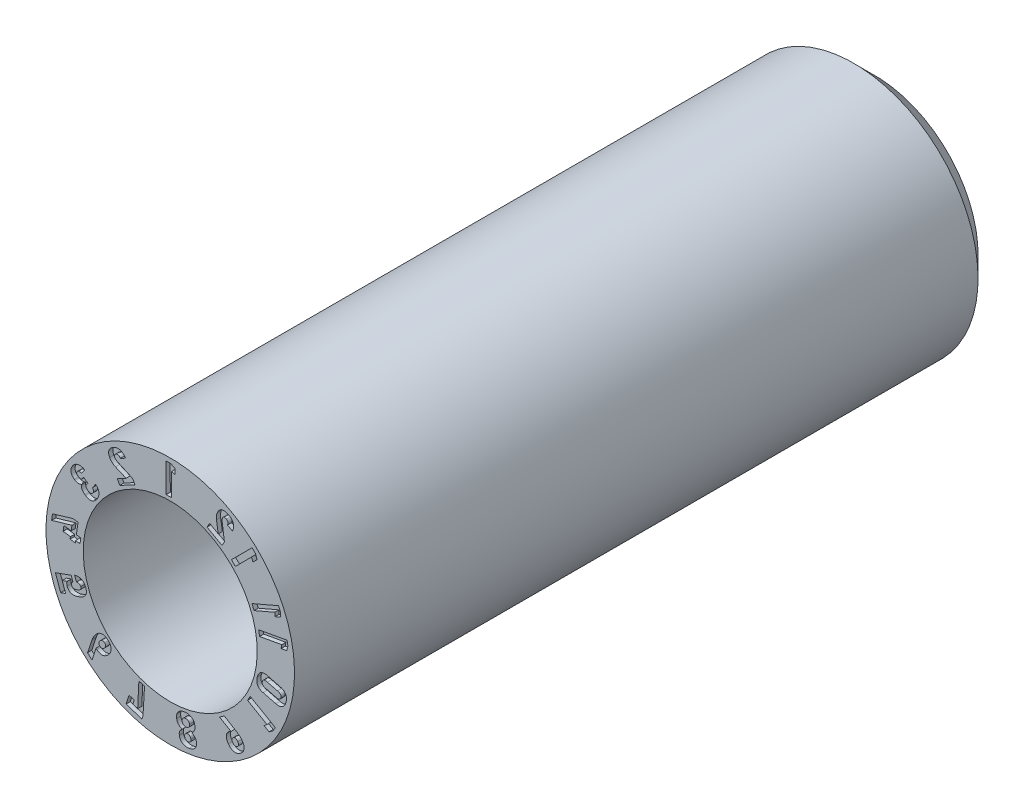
SolidWorks part; units mm, degrees
ref_plane "Front Plane" through (0, 0, 0) normal (0, 0, 1) x (1, 0, 0)
ref_plane "Top Plane" through (0, 0, 0) normal (0, 1, 0) x (1, 0, 0)
ref_plane "Right Plane" through (0, 0, 0) normal (1, 0, 0) x (0, 0, -1)
sketch "Sketch1" plane through (0, 0, 0) normal (1, 0, 0) x (0, 0, -1)
  line L0 (0, 0) -> (25.4137, 0) construction
  line L2 (17, 1.5) -> (17, 2.5)
  line L4 (16.5, 3) -> (0, 3)
  line L5 (0, 3) -> (0, 2.1)
  line L7 (0, 2.1) -> (3, 2.1)
  line L8 (3, 2.1) -> (3, 0.8)
  line L9 (3, 0.8) -> (12, 0.8)
  line L10 (17, 1.5) -> (12, 1.5)
  line L11 (12, 0.8) -> (12, 1.5)
  line L12 (17, 2.5) -> (16.5, 3)
  point P6 (17, 3)
  dimension "D1" = 17
  dimension "D2" = 6
  dimension "D3" = 4.2
  dimension "D4" = 3
  dimension "D5" = 1.6
  dimension "D6" = 3
  dimension "D7" = 5
revolve "Revolve1" add sketch "Sketch1" angle 360 about L0
sketch "Sketch2" plane through (0, 0, 0) normal (0, 0, 1) x (1, 0, 0)
  line L0 (-0.0987, 2.1834) -> (0.0335, 2.1841)
  line L1 (0.0335, 2.1841) -> (0.0306, 2.7307)
  line L2 (0.0306, 2.7307) -> (0.1164, 2.6987)
  line L3 (0.1164, 2.6987) -> (0.1157, 2.8393)
  line L4 (0.1157, 2.8393) -> (0.0106, 2.8859)
  line L5 (0.0106, 2.8859) -> (-0.1023, 2.8853)
  line L6 (-0.1023, 2.8853) -> (-0.0987, 2.1834)
  line L7 (-0.9091, 2.1158) -> (-1.27, 2.2798)
  line L8 (-1.3405, 2.3386) -> (-1.3409, 2.3394)
  line L9 (-1.1999, 2.3893) -> (-1.1997, 2.3888)
  line L10 (-1.1997, 2.3888) -> (-1.0807, 2.4529)
  line L11 (-1.0807, 2.4529) -> (-1.0809, 2.4533)
  line L12 (-1.4621, 2.2785) -> (-1.4619, 2.278)
  line L13 (-1.3214, 2.15) -> (-1.0667, 2.0403)
  line L14 (-1.0667, 2.0403) -> (-1.2772, 1.9269)
  line L15 (-1.2772, 1.9269) -> (-1.2169, 1.8151)
  line L16 (-1.2169, 1.8151) -> (-0.8528, 2.0112)
  line L17 (-0.8528, 2.0112) -> (-0.9091, 2.1158)
  line L18 (-1.8019, 1.545) -> (-1.88, 1.4339)
  line L19 (-1.977, 1.3167) -> (-1.9904, 1.3261)
  line L20 (-2.0216, 1.4261) -> (-1.9876, 1.4743)
  line L21 (-1.9876, 1.4743) -> (-2.0913, 1.5472)
  line L22 (-2.0913, 1.5472) -> (-2.1253, 1.499)
  line L23 (-2.2144, 1.4976) -> (-2.2242, 1.5044)
  line L24 (-2.1416, 1.6044) -> (-2.0638, 1.7151)
  line L25 (-2.3162, 1.3967) -> (-2.299, 1.3846)
  line L26 (-2.0634, 1.2048) -> (-2.046, 1.1927)
  line L27 (-2.3464, 0.5569) -> (-2.843, 0.4089)
  line L28 (-2.843, 0.4089) -> (-2.8638, 0.2611)
  line L29 (-2.8638, 0.2611) -> (-2.3738, 0.404)
  line L30 (-2.3738, 0.404) -> (-2.3916, 0.2776)
  line L31 (-2.4176, 0.0926) -> (-2.2918, 0.0749)
  line L32 (-2.2918, 0.0749) -> (-2.2842, 0.1292)
  line L33 (-2.2263, 0.5399) -> (-2.3464, 0.5569)
  line L34 (-2.5671, 0.3024) -> (-2.5856, 0.1718)
  line L35 (-2.5856, 0.1718) -> (-2.41, 0.147)
  line L36 (-2.1774, 0.1142) -> (-2.1589, 0.2448)
  line L37 (-2.1589, 0.2448) -> (-2.2657, 0.2599)
  line L38 (-2.3072, -0.6044) -> (-2.3077, -0.6045)
  line L39 (-2.3077, -0.6045) -> (-2.2632, -0.7292)
  line L40 (-2.2632, -0.7292) -> (-2.2627, -0.729)
  line L41 (-2.218, -0.8704) -> (-2.2735, -0.8901)
  line L42 (-2.3505, -0.7675) -> (-2.392, -0.6512)
  line L43 (-2.392, -0.6512) -> (-2.7721, -0.7868)
  line L44 (-2.7721, -0.7868) -> (-2.6453, -1.1419)
  line L45 (-2.6453, -1.1419) -> (-2.5252, -1.099)
  line L46 (-2.5252, -1.099) -> (-2.6075, -0.8686)
  line L47 (-2.6075, -0.8686) -> (-2.4908, -0.8269)
  line L48 (-2.229, -1.0148) -> (-2.1735, -0.995)
  line L49 (-1.7904, -1.5806) -> (-1.7907, -1.5809)
  line L50 (-1.8896, -1.7544) -> (-1.9951, -2.07)
  line L51 (-1.9951, -2.07) -> (-1.8872, -2.1731)
  line L52 (-1.8872, -2.1731) -> (-1.7893, -1.871)
  line L54 (-1.4966, -1.8653) -> (-1.4963, -1.8652)
  line L55 (-1.5858, -1.768) -> (-1.5862, -1.7684)
  line L56 (-1.6911, -1.6673) -> (-1.6909, -1.667)
  line L57 (-0.6569, -2.7176) -> (-0.6211, -2.0858)
  line L58 (-0.6211, -2.0858) -> (-0.7576, -2.0425)
  line L59 (-0.7576, -2.0425) -> (-0.7859, -2.6352)
  line L60 (-0.7859, -2.6352) -> (-0.9006, -2.5987)
  line L61 (-0.9006, -2.5987) -> (-0.8687, -2.4981)
  line L62 (-0.8687, -2.4981) -> (-0.9946, -2.4582)
  line L63 (-0.9946, -2.4582) -> (-1.0651, -2.6802)
  line L64 (-1.0651, -2.6802) -> (-0.6834, -2.8013)
  line L65 (-0.6834, -2.8013) -> (-0.6569, -2.7176)
  line L66 (0.154, -2.3657) -> (0.1558, -2.3772)
  line L67 (0.2187, -2.6783) -> (0.2215, -2.6964)
  line L68 (0.6326, -2.6306) -> (0.6298, -2.6125)
  line L69 (0.5955, -2.3068) -> (0.5937, -2.2954)
  line L70 (0.4661, -2.3352) -> (0.4671, -2.3419)
  line L71 (0.2886, -2.37) -> (0.2875, -2.3629)
  line L72 (0.4983, -2.628) -> (0.4993, -2.6348)
  line L73 (0.3495, -2.6582) -> (0.3483, -2.651)
  line L75 (1.402, -2.2767) -> (1.4023, -2.2771)
  line L76 (1.7311, -2.0356) -> (1.7309, -2.0352)
  line L77 (1.58, -1.9107) -> (1.3037, -1.7421)
  line L78 (1.3037, -1.7421) -> (1.1913, -1.8237)
  line L79 (1.1913, -1.8237) -> (1.4667, -1.9853)
  line L80 (1.6282, -2.1174) -> (1.6285, -2.1178)
  line L81 (1.5106, -2.2027) -> (1.5102, -2.2023)
  line L82 (1.9319, -1.0216) -> (1.8661, -1.1352)
  line L83 (1.8661, -1.1352) -> (2.3356, -1.4072)
  line L84 (2.3356, -1.4072) -> (2.265, -1.4646)
  line L85 (2.265, -1.4646) -> (2.3858, -1.5345)
  line L86 (2.3858, -1.5345) -> (2.4786, -1.4681)
  line L87 (2.4786, -1.4681) -> (2.5348, -1.3711)
  line L88 (2.5348, -1.3711) -> (1.9319, -1.0216)
  line L89 (2.2403, -0.7867) -> (2.5498, -0.8652)
  line L90 (2.653, -0.4579) -> (2.3435, -0.3794)
  line L91 (2.3439, -0.516) -> (2.5878, -0.578)
  line L92 (2.5495, -0.7286) -> (2.3057, -0.6667)
  line L93 (2.1337, 0.4734) -> (2.1571, 0.3438)
  line L94 (2.1571, 0.3438) -> (2.6922, 0.4405)
  line L95 (2.6922, 0.4405) -> (2.6755, 0.3512)
  line L96 (2.6755, 0.3512) -> (2.8131, 0.376)
  line L97 (2.8131, 0.376) -> (2.8409, 0.4869)
  line L98 (2.8409, 0.4869) -> (2.8209, 0.5975)
  line L99 (2.8209, 0.5975) -> (2.1337, 0.4734)
  line L100 (1.9726, 0.9402) -> (2.0246, 0.8192)
  line L101 (2.0246, 0.8192) -> (2.5239, 1.0342)
  line L102 (2.5239, 1.0342) -> (2.5279, 0.9436)
  line L103 (2.5279, 0.9436) -> (2.6563, 0.9988)
  line L104 (2.6563, 0.9988) -> (2.6583, 1.1131)
  line L105 (2.6583, 1.1131) -> (2.6139, 1.2162)
  line L106 (2.6139, 1.2162) -> (1.9726, 0.9402)
  line L107 (1.4782, 1.61) -> (1.5723, 1.5162)
  line L108 (1.5723, 1.5162) -> (1.9593, 1.905)
  line L109 (1.9593, 1.905) -> (1.9973, 1.8216)
  line L110 (1.9973, 1.8216) -> (2.0967, 1.9214)
  line L111 (2.0967, 1.9214) -> (2.0556, 2.0294)
  line L112 (2.0556, 2.0294) -> (1.9752, 2.1093)
  line L113 (1.9752, 2.1093) -> (1.4782, 1.61)
  line L114 (1.3071, 1.8963) -> (1.2536, 2.2895)
  line L115 (1.2658, 2.3805) -> (1.2662, 2.3812)
  line L116 (1.3834, 2.2882) -> (1.3832, 2.2878)
  line L117 (1.3832, 2.2878) -> (1.5011, 2.2211)
  line L118 (1.5011, 2.2211) -> (1.5013, 2.2216)
  line L119 (1.1502, 2.4515) -> (1.1499, 2.4512)
  line L120 (1.1163, 2.2638) -> (1.1589, 1.9896)
  line L121 (1.1589, 1.9896) -> (0.9507, 2.1075)
  line L122 (0.9507, 2.1075) -> (0.888, 1.9968)
  line L123 (0.888, 1.9968) -> (1.2485, 1.7927)
  line L124 (1.2485, 1.7927) -> (1.3071, 1.8963)
  line L125 (-2.41, 0.147) -> (-2.4176, 0.0926)
  line L126 (-2.3916, 0.2776) -> (-2.5671, 0.3024)
  line L127 (-2.2657, 0.2599) -> (-2.2263, 0.5399)
  line L128 (-2.2842, 0.1292) -> (-2.1774, 0.1142)
  circle A0 centre (0, 0) radius 2.19 construction
  spline S0 degree 3 poles (-1.27, 2.2798) (-1.2852, 2.2868) (-1.3035, 2.2972) (-1.3214, 2.3137) (-1.3313, 2.3241) (-1.3372, 2.3327) (-1.3405, 2.3386) knots 0 0 0 0 0.540031 0.665532 0.783527 1 1 1 1
  spline S1 degree 3 poles (-1.3409, 2.3394) (-1.3452, 2.3469) (-1.3493, 2.3589) (-1.3491, 2.3754) (-1.3459, 2.3869) (-1.3401, 2.3978) (-1.3281, 2.412) (-1.3159, 2.4199) (-1.3071, 2.4247) knots 0 0 0 0 0.246786 0.35691 0.469448 0.586307 0.710254 1 1 1 1
  spline S2 degree 3 poles (-1.3071, 2.4247) (-1.2983, 2.4294) (-1.284, 2.4345) (-1.2643, 2.4345) (-1.25, 2.4313) (-1.2363, 2.4251) (-1.218, 2.4124) (-1.2067, 2.3991) (-1.1999, 2.3893) knots 0 0 0 0 0.240301 0.353786 0.468513 0.587497 0.712892 1 1 1 1
  spline S3 degree 3 poles (-1.0809, 2.4533) (-1.0919, 2.4707) (-1.1101, 2.4948) (-1.1389, 2.5215) (-1.1614, 2.5375) (-1.185, 2.5502) (-1.2095, 2.5594) (-1.2349, 2.5646) (-1.2608, 2.5665) (-1.2872, 2.5647) (-1.3234, 2.5569) (-1.3497, 2.5462) (-1.3665, 2.537) knots 0 0 0 0 0.185247 0.270908 0.353799 0.433963 0.511943 0.589015 0.666847 0.746166 0.827199 1 1 1 1
  spline S4 degree 3 poles (-1.3665, 2.537) (-1.3843, 2.5274) (-1.4093, 2.5113) (-1.4378, 2.4857) (-1.4549, 2.4657) (-1.4687, 2.4448) (-1.4788, 2.423) (-1.4855, 2.4002) (-1.4881, 2.3766) (-1.4874, 2.3525) (-1.4808, 2.3188) (-1.4707, 2.2943) (-1.4621, 2.2785) knots 0 0 0 0 0.194583 0.283015 0.366623 0.445927 0.521986 0.596945 0.671952 0.748458 0.827747 1 1 1 1
  spline S5 degree 3 poles (-1.4619, 2.278) (-1.4542, 2.2641) (-1.4412, 2.2439) (-1.42, 2.2196) (-1.4027, 2.2024) (-1.384, 2.1866) (-1.3574, 2.168) (-1.3362, 2.1564) (-1.3214, 2.15) knots 0 0 0 0 0.246636 0.37153 0.498651 0.625609 0.751024 1 1 1 1
  spline S6 degree 3 poles (-1.7706, 1.2497) (-1.7591, 1.2661) (-1.7441, 1.2917) (-1.7306, 1.328) (-1.724, 1.3547) (-1.7212, 1.3814) (-1.7215, 1.4078) (-1.726, 1.4335) (-1.7336, 1.4586) (-1.7452, 1.4827) (-1.7661, 1.5135) (-1.7866, 1.5333) (-1.8019, 1.545) knots 0 0 0 0 0.181473 0.266228 0.349031 0.429721 0.5081 0.58621 0.664895 0.744781 0.826358 1 1 1 1
  spline S7 degree 3 poles (-1.88, 1.4339) (-1.8749, 1.4293) (-1.8681, 1.4218) (-1.861, 1.4108) (-1.8569, 1.4026) (-1.8542, 1.3941) (-1.8525, 1.3856) (-1.8521, 1.377) (-1.8526, 1.3684) (-1.8545, 1.3598) (-1.8584, 1.3481) (-1.8634, 1.3401) (-1.8668, 1.3348) knots 0 0 0 0 0.185948 0.272003 0.355057 0.435081 0.512073 0.590042 0.667455 0.74622 0.82701 1 1 1 1
  spline S8 degree 3 poles (-1.8668, 1.3348) (-1.8732, 1.3255) (-1.8844, 1.3134) (-1.9028, 1.3029) (-1.9171, 1.299) (-1.9319, 1.2983) (-1.953, 1.3023) (-1.9677, 1.3103) (-1.977, 1.3167) knots 0 0 0 0 0.265502 0.382854 0.496664 0.611875 0.731229 1 1 1 1
  spline S9 degree 3 poles (-1.9904, 1.3261) (-1.9998, 1.3331) (-2.0135, 1.3437) (-2.0257, 1.3617) (-2.0316, 1.3745) (-2.0343, 1.3877) (-2.0329, 1.4059) (-2.0272, 1.4186) (-2.0216, 1.4261) knots 0 0 0 0 0.300615 0.42856 0.545417 0.656048 0.764757 1 1 1 1
  spline S10 degree 3 poles (-2.1253, 1.499) (-2.1295, 1.4926) (-2.1379, 1.4849) (-2.1519, 1.4791) (-2.1633, 1.4779) (-2.1754, 1.4788) (-2.1933, 1.4845) (-2.2062, 1.4915) (-2.2144, 1.4976) knots 0 0 0 0 0.226653 0.333129 0.444988 0.564971 0.694922 1 1 1 1
  spline S11 degree 3 poles (-2.2242, 1.5044) (-2.2319, 1.51) (-2.2427, 1.519) (-2.2523, 1.534) (-2.2565, 1.5451) (-2.2579, 1.5566) (-2.2565, 1.5725) (-2.2505, 1.5835) (-2.2459, 1.5902) knots 0 0 0 0 0.287811 0.411477 0.527914 0.639876 0.752931 1 1 1 1
  spline S12 degree 3 poles (-2.2459, 1.5902) (-2.2426, 1.5949) (-2.2368, 1.6014) (-2.2274, 1.6078) (-2.2198, 1.6117) (-2.2116, 1.6147) (-2.2029, 1.6164) (-2.1936, 1.6171) (-2.1839, 1.6168) (-2.1737, 1.6153) (-2.1593, 1.6119) (-2.1487, 1.6076) (-2.1416, 1.6044) knots 0 0 0 0 0.150181 0.223297 0.297156 0.371585 0.449302 0.529052 0.614285 0.702509 0.795753 1 1 1 1
  spline S13 degree 3 poles (-2.0638, 1.7151) (-2.0812, 1.7252) (-2.1084, 1.7376) (-2.146, 1.7474) (-2.1733, 1.7508) (-2.2001, 1.7509) (-2.2261, 1.7475) (-2.2509, 1.7405) (-2.2747, 1.7304) (-2.297, 1.717) (-2.3252, 1.6953) (-2.3428, 1.6746) (-2.3532, 1.6599) knots 0 0 0 0 0.185488 0.271925 0.356057 0.43765 0.517094 0.59543 0.674143 0.753752 0.833671 1 1 1 1
  spline S14 degree 3 poles (-2.3532, 1.6599) (-2.3618, 1.648) (-2.3727, 1.6296) (-2.3845, 1.6044) (-2.3911, 1.5862) (-2.3956, 1.5681) (-2.3981, 1.5503) (-2.3987, 1.5326) (-2.3971, 1.5153) (-2.3939, 1.4984) (-2.3884, 1.4821) (-2.3813, 1.4663) (-2.3722, 1.451) (-2.361, 1.4364) (-2.343, 1.4175) (-2.3276, 1.4045) (-2.3162, 1.3967) knots 0 0 0 0 0.145025 0.211773 0.27583 0.33709 0.396198 0.454481 0.511605 0.568407 0.62506 0.681891 0.740574 0.801023 0.863801 1 1 1 1
  spline S15 degree 3 poles (-2.299, 1.3846) (-2.2864, 1.376) (-2.2665, 1.3648) (-2.2374, 1.3577) (-2.2158, 1.3554) (-2.1941, 1.3568) (-2.165, 1.3635) (-2.1446, 1.3736) (-2.1317, 1.382) knots 0 0 0 0 0.256766 0.378903 0.500094 0.620744 0.742279 1 1 1 1
  spline S16 degree 3 poles (-2.1317, 1.382) (-2.135, 1.3743) (-2.1385, 1.3625) (-2.1413, 1.3464) (-2.1421, 1.3346) (-2.1416, 1.3227) (-2.1402, 1.3109) (-2.1373, 1.2993) (-2.1322, 1.2836) (-2.1227, 1.2645) (-2.101, 1.2348) (-2.0794, 1.216) (-2.0634, 1.2048) knots 0 0 0 0 0.120942 0.178738 0.235933 0.293132 0.35041 0.408041 0.467423 0.589012 0.716166 1 1 1 1
  spline S17 degree 3 poles (-2.046, 1.1927) (-2.0303, 1.182) (-2.0063, 1.1677) (-1.972, 1.1564) (-1.9472, 1.1518) (-1.9226, 1.151) (-1.8986, 1.1542) (-1.875, 1.1608) (-1.8523, 1.1716) (-1.8301, 1.1858) (-1.801, 1.2104) (-1.7823, 1.2333) (-1.7706, 1.2497) knots 0 0 0 0 0.178299 0.259715 0.338099 0.414262 0.489196 0.564778 0.643204 0.724723 0.810858 1 1 1 1
  spline S18 degree 3 poles (-2.0403, -0.7275) (-2.0462, -0.7104) (-2.0582, -0.6864) (-2.0794, -0.6581) (-2.0975, -0.6397) (-2.1178, -0.624) (-2.1403, -0.6117) (-2.1645, -0.602) (-2.1907, -0.5957) (-2.2183, -0.5926) (-2.2577, -0.5932) (-2.2875, -0.5988) (-2.3072, -0.6044) knots 0 0 0 0 0.165351 0.244288 0.323078 0.400982 0.47883 0.557644 0.639484 0.72423 0.811685 1 1 1 1
  spline S19 degree 3 poles (-2.2627, -0.729) (-2.2514, -0.7261) (-2.2343, -0.7236) (-2.2125, -0.7262) (-2.1982, -0.7305) (-2.1856, -0.7375) (-2.171, -0.7502) (-2.164, -0.7634) (-2.1606, -0.7725) knots 0 0 0 0 0.28598 0.412917 0.532389 0.648289 0.760986 1 1 1 1
  spline S20 degree 3 poles (-2.1606, -0.7725) (-2.1572, -0.7823) (-2.1538, -0.7978) (-2.1576, -0.8178) (-2.1635, -0.8313) (-2.1728, -0.8434) (-2.1899, -0.8586) (-2.2064, -0.8661) (-2.218, -0.8704) knots 0 0 0 0 0.245538 0.357255 0.469313 0.585745 0.711147 1 1 1 1
  spline S21 degree 3 poles (-2.2735, -0.8901) (-2.2851, -0.8943) (-2.3023, -0.8988) (-2.3248, -0.899) (-2.3392, -0.896) (-2.3519, -0.8905) (-2.3664, -0.879) (-2.3736, -0.8668) (-2.3766, -0.8579) knots 0 0 0 0 0.302844 0.431574 0.550434 0.661796 0.769579 1 1 1 1
  spline S22 degree 3 poles (-2.3766, -0.8579) (-2.3796, -0.8496) (-2.3825, -0.8366) (-2.3821, -0.8194) (-2.3797, -0.8073) (-2.3752, -0.7958) (-2.3666, -0.7814) (-2.3573, -0.7726) (-2.3505, -0.7675) knots 0 0 0 0 0.263342 0.385863 0.507648 0.627192 0.748066 1 1 1 1
  spline S23 degree 3 poles (-2.4908, -0.8269) (-2.4939, -0.8335) (-2.4967, -0.8446) (-2.4986, -0.8603) (-2.4989, -0.8861) (-2.4949, -0.9078) (-2.4893, -0.9243) knots 0 0 0 0 0.221259 0.342937 0.474198 1 1 1 1
  spline S24 degree 3 poles (-2.4893, -0.9243) (-2.4835, -0.9404) (-2.4724, -0.963) (-2.452, -0.9886) (-2.4346, -1.0041) (-2.4152, -1.0169) (-2.3936, -1.0263) (-2.3701, -1.0323) (-2.3448, -1.0354) (-2.3178, -1.0349) (-2.2784, -1.0306) (-2.2489, -1.0217) (-2.229, -1.0148) knots 0 0 0 0 0.163657 0.239511 0.313509 0.387354 0.461741 0.538607 0.619723 0.705858 0.797119 1 1 1 1
  spline S25 degree 3 poles (-2.1735, -0.995) (-2.1536, -0.9879) (-2.1253, -0.9751) (-2.0924, -0.9523) (-2.0719, -0.9336) (-2.0549, -0.9131) (-2.0415, -0.8908) (-2.0318, -0.8668) (-2.0258, -0.8413) (-2.0237, -0.8144) (-2.0259, -0.7758) (-2.0336, -0.7468) (-2.0403, -0.7275) knots 0 0 0 0 0.18694 0.272046 0.353269 0.43122 0.506711 0.581925 0.65865 0.737396 0.819504 1 1 1 1
  spline S26 degree 3 poles (-1.4966, -1.5692) (-1.5111, -1.5553) (-1.5342, -1.5369) (-1.5681, -1.5192) (-1.5932, -1.5101) (-1.6186, -1.5053) (-1.644, -1.5042) (-1.6694, -1.5071) (-1.6947, -1.514) (-1.7196, -1.5251) (-1.7534, -1.5452) (-1.7759, -1.5658) (-1.7904, -1.5806) knots 0 0 0 0 0.180177 0.262991 0.342265 0.419093 0.494073 0.569807 0.647689 0.728634 0.813436 1 1 1 1
  spline S27 degree 3 poles (-1.7907, -1.5809) (-1.7998, -1.5903) (-1.8126, -1.6056) (-1.8283, -1.6275) (-1.8518, -1.6644) (-1.8679, -1.6977) (-1.8789, -1.7254) knots 0 0 0 0 0.230123 0.350639 0.475699 1 1 1 1
  spline S28 degree 3 poles (-1.8789, -1.7254) (-1.8808, -1.7302) (-1.8849, -1.7397) (-1.8879, -1.7496) (-1.8896, -1.7544) knots 0 0 0 0 0.50536 1 1 1 1
  spline S29 degree 3 poles (-1.7893, -1.871) (-1.7844, -1.878) (-1.7787, -1.8843) (-1.7726, -1.8902) knots 0.759919 0.759919 0.759919 0.759919 1 1 1 1
  spline S30 degree 3 poles (-1.7726, -1.8902) (-1.7596, -1.9026) (-1.7387, -1.9191) (-1.7077, -1.934) (-1.6846, -1.9413) (-1.661, -1.9446) (-1.6372, -1.9445) (-1.6133, -1.9402) (-1.5893, -1.9325) (-1.5655, -1.9209) (-1.5328, -1.9004) (-1.5108, -1.8801) (-1.4966, -1.8653) knots 0 0 0 0 0.171911 0.25061 0.326761 0.401984 0.476839 0.553147 0.632554 0.716253 0.804371 1 1 1 1
  spline S31 degree 3 poles (-1.4963, -1.8652) (-1.4816, -1.8501) (-1.4625, -1.826) (-1.4433, -1.7912) (-1.4334, -1.7655) (-1.4272, -1.7398) (-1.4254, -1.714) (-1.4273, -1.6885) (-1.4335, -1.6633) (-1.4434, -1.6386) (-1.4627, -1.6055) (-1.4821, -1.5831) (-1.4966, -1.5692) knots 0 0 0 0 0.187278 0.272507 0.353965 0.431955 0.507955 0.583051 0.659476 0.73806 0.820178 1 1 1 1
  spline S32 degree 3 poles (-1.5845, -1.661) (-1.5769, -1.6682) (-1.567, -1.6803) (-1.5604, -1.6992) (-1.559, -1.7132) (-1.5609, -1.7274) (-1.5681, -1.747) (-1.578, -1.76) (-1.5858, -1.768) knots 0 0 0 0 0.25988 0.375973 0.488654 0.604089 0.724464 1 1 1 1
  spline S33 degree 3 poles (-1.5862, -1.7684) (-1.5951, -1.7776) (-1.6091, -1.7902) (-1.6305, -1.8002) (-1.6456, -1.8041) (-1.6606, -1.8042) (-1.6806, -1.7995) (-1.6936, -1.7903) (-1.7012, -1.783) knots 0 0 0 0 0.294468 0.419976 0.537202 0.647939 0.758507 1 1 1 1
  spline S34 degree 3 poles (-1.7012, -1.783) (-1.7088, -1.7759) (-1.7184, -1.7632) (-1.7237, -1.7434) (-1.724, -1.7284) (-1.7209, -1.713) (-1.7114, -1.6913) (-1.7001, -1.6765) (-1.6911, -1.6673) knots 0 0 0 0 0.24016 0.350245 0.463156 0.580574 0.706813 1 1 1 1
  spline S35 degree 3 poles (-1.6909, -1.667) (-1.6832, -1.659) (-1.6706, -1.6486) (-1.6514, -1.6403) (-1.6374, -1.638) (-1.6234, -1.6387) (-1.6045, -1.6448) (-1.5919, -1.6537) (-1.5845, -1.661) knots 0 0 0 0 0.277062 0.397428 0.512563 0.62626 0.741394 1 1 1 1
  spline S36 degree 3 poles (0.343, -2.1378) (0.3223, -2.1413) (0.2921, -2.1483) (0.2555, -2.165) (0.2311, -2.1795) (0.2097, -2.1965) (0.1912, -2.2154) (0.1762, -2.2367) (0.1644, -2.2598) (0.156, -2.2845) (0.15, -2.32) (0.1509, -2.3475) (0.154, -2.3657) knots 0 0 0 0 0.188977 0.27682 0.361569 0.443246 0.522148 0.599298 0.677101 0.755105 0.83325 1 1 1 1
  spline S37 degree 3 poles (0.1558, -2.3772) (0.1585, -2.3942) (0.1664, -2.4191) (0.1834, -2.4496) (0.1997, -2.4706) (0.2183, -2.4897) (0.2466, -2.5109) (0.2706, -2.5222) (0.2874, -2.5272) knots 0 0 0 0 0.24595 0.369875 0.497302 0.624923 0.749887 1 1 1 1
  spline S38 degree 3 poles (0.2874, -2.5272) (0.2752, -2.5358) (0.2584, -2.5509) (0.2409, -2.5752) (0.2303, -2.5948) (0.2225, -2.6153) (0.2162, -2.6431) (0.2164, -2.6645) (0.2187, -2.6783) knots 0 0 0 0 0.256726 0.383635 0.511859 0.637851 0.759402 1 1 1 1
  spline S39 degree 3 poles (0.2215, -2.6964) (0.2243, -2.7136) (0.2313, -2.7386) (0.2472, -2.7685) (0.2619, -2.7883) (0.2791, -2.8056) (0.2989, -2.82) (0.3206, -2.832) (0.3447, -2.8408) (0.3706, -2.847) (0.4081, -2.8505) (0.4369, -2.849) (0.4562, -2.8456) knots 0 0 0 0 0.166884 0.246053 0.324356 0.402056 0.479239 0.557959 0.639716 0.724649 0.812019 1 1 1 1
  spline S40 degree 3 poles (0.4562, -2.8456) (0.4755, -2.8423) (0.5037, -2.8356) (0.5379, -2.82) (0.5606, -2.8063) (0.5806, -2.7903) (0.5979, -2.7722) (0.6119, -2.7522) (0.623, -2.7304) (0.6306, -2.7071) (0.6367, -2.6737) (0.6353, -2.6478) (0.6326, -2.6306) knots 0 0 0 0 0.188035 0.275676 0.359981 0.441818 0.520591 0.598495 0.675899 0.754169 0.832942 1 1 1 1
  spline S41 degree 3 poles (0.6298, -2.6125) (0.6278, -2.5984) (0.6209, -2.5779) (0.6062, -2.5531) (0.592, -2.5362) (0.5756, -2.5211) (0.5513, -2.5036) (0.5303, -2.495) (0.5159, -2.4907) knots 0 0 0 0 0.242626 0.3641 0.490539 0.617681 0.743637 1 1 1 1
  spline S42 degree 3 poles (0.5159, -2.4907) (0.5306, -2.4807) (0.5498, -2.4621) (0.5705, -2.4331) (0.5825, -2.4092) (0.5916, -2.3842) (0.5988, -2.35) (0.5983, -2.3238) (0.5955, -2.3068) knots 0 0 0 0 0.252226 0.376998 0.504745 0.631563 0.754935 1 1 1 1
  spline S43 degree 3 poles (0.5937, -2.2954) (0.591, -2.277) (0.5833, -2.2506) (0.5664, -2.2188) (0.5508, -2.198) (0.5323, -2.1798) (0.5116, -2.164) (0.4879, -2.1519) (0.4623, -2.1424) (0.4346, -2.1363) (0.3946, -2.1321) (0.3637, -2.1345) (0.343, -2.1378) knots 0 0 0 0 0.166554 0.245226 0.322916 0.400249 0.47767 0.556369 0.63832 0.723174 0.810916 1 1 1 1
  spline S44 degree 3 poles (0.3632, -2.2637) (0.3715, -2.2623) (0.384, -2.2617) (0.4002, -2.2637) (0.4114, -2.2668) (0.4219, -2.2713) (0.4317, -2.2767) (0.4402, -2.2839) (0.4478, -2.2921) (0.4544, -2.3015) (0.4617, -2.3155) (0.4648, -2.3272) (0.4661, -2.3352) knots 0 0 0 0 0.180053 0.264369 0.347011 0.427481 0.50643 0.584318 0.66459 0.745066 0.82721 1 1 1 1
  spline S45 degree 3 poles (0.4671, -2.3419) (0.4681, -2.3493) (0.4688, -2.3605) (0.4662, -2.3749) (0.4627, -2.3849) (0.4578, -2.3942) (0.4518, -2.4029) (0.4443, -2.4106) (0.4356, -2.4175) (0.4257, -2.4234) (0.411, -2.4302) (0.3988, -2.4331) (0.3904, -2.4345) knots 0 0 0 0 0.166389 0.245774 0.324127 0.401036 0.478754 0.557638 0.639825 0.724353 0.811459 1 1 1 1
  spline S46 degree 3 poles (0.3904, -2.4345) (0.382, -2.4357) (0.3695, -2.4368) (0.3533, -2.4351) (0.3422, -2.4325) (0.3318, -2.4287) (0.3224, -2.4234) (0.3138, -2.4172) (0.3062, -2.4097) (0.2997, -2.4011) (0.2929, -2.3882) (0.2897, -2.3775) (0.2886, -2.37) knots 0 0 0 0 0.188474 0.275198 0.360269 0.441191 0.520185 0.597926 0.676115 0.755046 0.834173 1 1 1 1
  spline S47 degree 3 poles (0.2875, -2.3629) (0.2862, -2.3549) (0.2857, -2.3429) (0.288, -2.3273) (0.2914, -2.3165) (0.296, -2.3063) (0.3021, -2.2971) (0.3096, -2.2888) (0.3183, -2.2815) (0.328, -2.2751) (0.3429, -2.2683) (0.3548, -2.2649) (0.3632, -2.2637) knots 0 0 0 0 0.173778 0.254718 0.335683 0.414821 0.493743 0.571177 0.652365 0.735479 0.820481 1 1 1 1
  spline S48 degree 3 poles (0.4108, -2.5613) (0.4178, -2.56) (0.4285, -2.5596) (0.4422, -2.5617) (0.4517, -2.5646) (0.4606, -2.5687) (0.4688, -2.574) (0.4762, -2.5804) (0.4826, -2.5882) (0.4882, -2.5969) (0.4942, -2.61) (0.4973, -2.6206) (0.4983, -2.628) knots 0 0 0 0 0.173838 0.255177 0.335334 0.414326 0.491269 0.570236 0.650821 0.73402 0.818688 1 1 1 1
  spline S49 degree 3 poles (0.4993, -2.6348) (0.5003, -2.6416) (0.5011, -2.652) (0.499, -2.6653) (0.4964, -2.6745) (0.4926, -2.6833) (0.4874, -2.6911) (0.4813, -2.6983) (0.474, -2.7045) (0.4658, -2.71) (0.4534, -2.7159) (0.4431, -2.7184) (0.436, -2.7197) knots 0 0 0 0 0.175248 0.257091 0.338037 0.416807 0.495075 0.573435 0.65385 0.735675 0.820091 1 1 1 1
  spline S50 degree 3 poles (0.436, -2.7197) (0.429, -2.7207) (0.4184, -2.7217) (0.4048, -2.7196) (0.3952, -2.7173) (0.3864, -2.7135) (0.3783, -2.7086) (0.371, -2.7026) (0.3647, -2.6955) (0.3591, -2.6874) (0.3533, -2.6751) (0.3505, -2.6651) (0.3495, -2.6582) knots 0 0 0 0 0.179112 0.262747 0.344694 0.424028 0.50258 0.580234 0.659693 0.741501 0.824387 1 1 1 1
  spline S51 degree 3 poles (0.3483, -2.651) (0.347, -2.6438) (0.3466, -2.633) (0.3481, -2.6189) (0.3509, -2.6091) (0.3546, -2.5999) (0.3595, -2.5914) (0.3658, -2.584) (0.3729, -2.5772) (0.3811, -2.5716) (0.3934, -2.5652) (0.4037, -2.5624) (0.4108, -2.5613) knots 0 0 0 0 0.178209 0.262814 0.344874 0.425545 0.504461 0.582683 0.662101 0.743229 0.825445 1 1 1 1
  spline S52 degree 3 poles (1.4667, -1.9853) (1.466, -1.9856) (1.4609, -1.9873) (1.4463, -1.9933) (1.4337, -2.0016) (1.4252, -2.0075) knots 0.563272 0.563272 0.563272 0.563272 0.582457 0.712545 1 1 1 1
  spline S53 degree 3 poles (1.4252, -2.0075) (1.4118, -2.0174) (1.3933, -2.0341) (1.3749, -2.061) (1.3644, -2.0823) (1.3575, -2.1049) (1.3535, -2.1284) (1.3534, -2.1526) (1.3564, -2.1775) (1.3629, -2.2026) (1.376, -2.237) (1.3909, -2.2611) (1.402, -2.2767) knots 0 0 0 0 0.164687 0.243 0.320771 0.398263 0.475705 0.554876 0.637235 0.722309 0.810467 1 1 1 1
  spline S54 degree 3 poles (1.4023, -2.2771) (1.4148, -2.2939) (1.4346, -2.3176) (1.4656, -2.3424) (1.4889, -2.357) (1.5131, -2.3674) (1.5378, -2.3741) (1.5632, -2.3767) (1.589, -2.3752) (1.6151, -2.3698) (1.6511, -2.3568) (1.6766, -2.3418) (1.6928, -2.3299) knots 0 0 0 0 0.187675 0.273076 0.354399 0.432079 0.507842 0.582608 0.659159 0.737961 0.820071 1 1 1 1
  spline S55 degree 3 poles (1.6928, -2.3299) (1.7091, -2.3183) (1.7312, -2.2988) (1.7545, -2.2686) (1.7676, -2.2453) (1.7767, -2.221) (1.7821, -2.1959) (1.7832, -2.17) (1.7807, -2.1435) (1.7742, -2.1165) (1.7594, -2.0792) (1.7438, -2.0525) (1.7311, -2.0356) knots 0 0 0 0 0.17805 0.259654 0.33813 0.414765 0.490064 0.565894 0.644319 0.726149 0.811832 1 1 1 1
  spline S56 degree 3 poles (1.7309, -2.0352) (1.7238, -2.0253) (1.7116, -2.0112) (1.6935, -1.9933) (1.6782, -1.9798) (1.6616, -1.9663) (1.637, -1.9479) (1.6176, -1.9345) (1.6041, -1.9258) knots 0 0 0 0 0.216627 0.332173 0.453194 0.580305 0.713714 1 1 1 1
  spline S57 degree 3 poles (1.6041, -1.9258) (1.6001, -1.9231) (1.5921, -1.9181) (1.5843, -1.9128) (1.58, -1.9107) knots 0 0 0 0 0.504712 1 1 1 1
  spline S58 degree 3 poles (1.5194, -2.0908) (1.5278, -2.0847) (1.5416, -2.0774) (1.5617, -2.0752) (1.5762, -2.0771) (1.5904, -2.0822) (1.6093, -2.0945) (1.6212, -2.1075) (1.6282, -2.1174) knots 0 0 0 0 0.246693 0.358778 0.471984 0.588823 0.71275 1 1 1 1
  spline S59 degree 3 poles (1.6285, -2.1178) (1.6353, -2.1274) (1.6441, -2.1421) (1.649, -2.1633) (1.6494, -2.178) (1.6464, -2.1921) (1.6374, -2.2099) (1.6265, -2.2208) (1.618, -2.2268) knots 0 0 0 0 0.28325 0.406265 0.522769 0.635825 0.748302 1 1 1 1
  spline S60 degree 3 poles (1.618, -2.2268) (1.6095, -2.2328) (1.5957, -2.2403) (1.5757, -2.2429) (1.5614, -2.2415) (1.5475, -2.2366) (1.5289, -2.225) (1.5174, -2.2123) (1.5106, -2.2027) knots 0 0 0 0 0.252145 0.365992 0.478155 0.594598 0.717793 1 1 1 1
  spline S61 degree 3 poles (1.5102, -2.2023) (1.5031, -2.1925) (1.4943, -2.1772) (1.4887, -2.1555) (1.4882, -2.1405) (1.4909, -2.1262) (1.4997, -2.108) (1.5109, -2.0969) (1.5194, -2.0908) knots 0 0 0 0 0.28754 0.410631 0.526441 0.638437 0.751688 1 1 1 1
  spline S62 degree 3 poles (2.0986, -0.534) (2.0947, -0.5497) (2.09, -0.5729) (2.0882, -0.6035) (2.0887, -0.6247) (2.0914, -0.6448) (2.0959, -0.6639) (2.1025, -0.6819) (2.111, -0.6987) (2.1215, -0.7143) (2.1336, -0.7287) (2.1471, -0.7419) (2.1626, -0.7535) (2.1797, -0.7638) (2.2052, -0.7763) (2.2259, -0.7831) (2.2403, -0.7867) knots 0 0 0 0 0.147108 0.214438 0.278381 0.339971 0.398767 0.456376 0.513598 0.57028 0.626979 0.683952 0.742119 0.80231 0.865074 1 1 1 1
  spline S63 degree 3 poles (2.5498, -0.8652) (2.5643, -0.8687) (2.5859, -0.8729) (2.6145, -0.8742) (2.6345, -0.8732) (2.6536, -0.8702) (2.6719, -0.8652) (2.6894, -0.8582) (2.7059, -0.8494) (2.7214, -0.8386) (2.7357, -0.8259) (2.7486, -0.8112) (2.7605, -0.7948) (2.7709, -0.7763) (2.7837, -0.7486) (2.791, -0.7262) (2.7948, -0.7105) knots 0 0 0 0 0.13594 0.198952 0.259288 0.317551 0.375017 0.431183 0.488003 0.54502 0.602438 0.66146 0.722464 0.786442 0.85357 1 1 1 1
  spline S64 degree 3 poles (2.7948, -0.7105) (2.7987, -0.6948) (2.8032, -0.6716) (2.8053, -0.641) (2.8049, -0.6198) (2.8023, -0.5997) (2.7979, -0.5806) (2.7916, -0.5626) (2.7831, -0.5458) (2.7728, -0.5303) (2.7608, -0.5159) (2.747, -0.5029) (2.7315, -0.4912) (2.7144, -0.4808) (2.6886, -0.4684) (2.6676, -0.4616) (2.653, -0.4579) knots 0 0 0 0 0.1469 0.213952 0.278179 0.339429 0.397853 0.455345 0.51213 0.56835 0.624568 0.681764 0.740276 0.800382 0.863507 1 1 1 1
  spline S65 degree 3 poles (2.3435, -0.3794) (2.329, -0.3759) (2.3074, -0.3717) (2.2789, -0.3704) (2.2589, -0.3714) (2.2398, -0.3744) (2.2215, -0.3794) (2.2041, -0.3863) (2.1876, -0.3952) (2.1721, -0.406) (2.1579, -0.4187) (2.1449, -0.4334) (2.133, -0.4498) (2.1225, -0.4681) (2.1097, -0.4959) (2.1026, -0.5184) (2.0986, -0.534) knots 0 0 0 0 0.136024 0.199076 0.25945 0.317748 0.374639 0.431449 0.487705 0.544759 0.602212 0.661271 0.722313 0.78634 0.85351 1 1 1 1
  spline S66 degree 3 poles (2.2221, -0.5654) (2.2236, -0.5593) (2.2266, -0.5506) (2.2322, -0.5401) (2.237, -0.5333) (2.2426, -0.5274) (2.2487, -0.5223) (2.2557, -0.5182) (2.2658, -0.5136) (2.2804, -0.5101) (2.3078, -0.5087) (2.3292, -0.5123) (2.3439, -0.516) knots 0 0 0 0 0.125633 0.182804 0.23847 0.291625 0.345061 0.398011 0.453087 0.568397 0.695558 1 1 1 1
  spline S67 degree 3 poles (2.5878, -0.578) (2.6024, -0.5818) (2.6232, -0.5884) (2.6464, -0.603) (2.6576, -0.6129) (2.6644, -0.6217) (2.6685, -0.6286) (2.6714, -0.6361) (2.6734, -0.6439) (2.6743, -0.6522) (2.6744, -0.6641) (2.6727, -0.6731) (2.6712, -0.6792) knots 0 0 0 0 0.304308 0.432419 0.547403 0.601642 0.655137 0.708632 0.761957 0.816738 0.874369 1 1 1 1
  spline S68 degree 3 poles (2.6712, -0.6792) (2.6697, -0.6853) (2.6668, -0.694) (2.6611, -0.7044) (2.6563, -0.7112) (2.6508, -0.7171) (2.6447, -0.7223) (2.6379, -0.7265) (2.6276, -0.7309) (2.6131, -0.7346) (2.5857, -0.7359) (2.5642, -0.7324) (2.5495, -0.7286) knots 0 0 0 0 0.125698 0.182899 0.238594 0.291777 0.344002 0.397805 0.452154 0.568172 0.6954 1 1 1 1
  spline S69 degree 3 poles (2.3057, -0.6667) (2.291, -0.6629) (2.2702, -0.6562) (2.247, -0.6417) (2.236, -0.6316) (2.2291, -0.6228) (2.2251, -0.6159) (2.222, -0.6085) (2.2201, -0.6007) (2.219, -0.5925) (2.219, -0.5805) (2.2207, -0.5715) (2.2221, -0.5654) knots 0 0 0 0 0.305203 0.43234 0.547537 0.601766 0.655252 0.708131 0.761446 0.816771 0.874391 1 1 1 1
  spline S70 degree 3 poles (1.2536, 2.2895) (1.2514, 2.3061) (1.2503, 2.3271) (1.2549, 2.3511) (1.2584, 2.365) (1.2627, 2.3745) (1.2658, 2.3805) knots 0 0 0 0 0.540854 0.665328 0.783096 1 1 1 1
  spline S71 degree 3 poles (1.2662, 2.3812) (1.2705, 2.3886) (1.2783, 2.3988) (1.2924, 2.4074) (1.3039, 2.4108) (1.3163, 2.4115) (1.3347, 2.4091) (1.348, 2.4028) (1.3567, 2.3981) knots 0 0 0 0 0.246977 0.357639 0.470298 0.587002 0.712461 1 1 1 1
  spline S72 degree 3 poles (1.3567, 2.3981) (1.3655, 2.3932) (1.3774, 2.3839) (1.3879, 2.3671) (1.3928, 2.3533) (1.3948, 2.3383) (1.3937, 2.3159) (1.3882, 2.2992) (1.3834, 2.2882) knots 0 0 0 0 0.240595 0.353002 0.467657 0.587204 0.712514 1 1 1 1
  spline S73 degree 3 poles (1.5013, 2.2216) (1.5102, 2.2401) (1.5211, 2.2685) (1.5283, 2.3072) (1.5299, 2.3349) (1.5281, 2.3617) (1.5226, 2.3873) (1.5138, 2.4116) (1.5013, 2.4345) (1.4856, 2.4558) (1.4602, 2.4827) (1.4366, 2.4986) (1.4201, 2.5082) knots 0 0 0 0 0.185812 0.271428 0.354384 0.434677 0.512593 0.589401 0.667461 0.746639 0.827415 1 1 1 1
  spline S74 degree 3 poles (1.4201, 2.5082) (1.4024, 2.518) (1.3757, 2.5312) (1.3387, 2.5412) (1.3128, 2.5454) (1.2877, 2.5459) (1.2638, 2.5425) (1.2409, 2.5361) (1.2195, 2.5258) (1.1994, 2.5123) (1.1745, 2.4886) (1.1588, 2.4673) (1.1502, 2.4515) knots 0 0 0 0 0.194492 0.282755 0.366202 0.44557 0.521879 0.596779 0.671827 0.748451 0.827594 1 1 1 1
  spline S75 degree 3 poles (1.1499, 2.4512) (1.1419, 2.4373) (1.1323, 2.4153) (1.1226, 2.3846) (1.1174, 2.3606) (1.1141, 2.3363) (1.1121, 2.3039) (1.114, 2.2797) (1.1163, 2.2638) knots 0 0 0 0 0.246329 0.371481 0.498035 0.625315 0.750897 1 1 1 1
  dimension "D1" = 4.38
extrude "Cut-Extrude1" cut sketch "Sketch2" against normal blind 0.1
